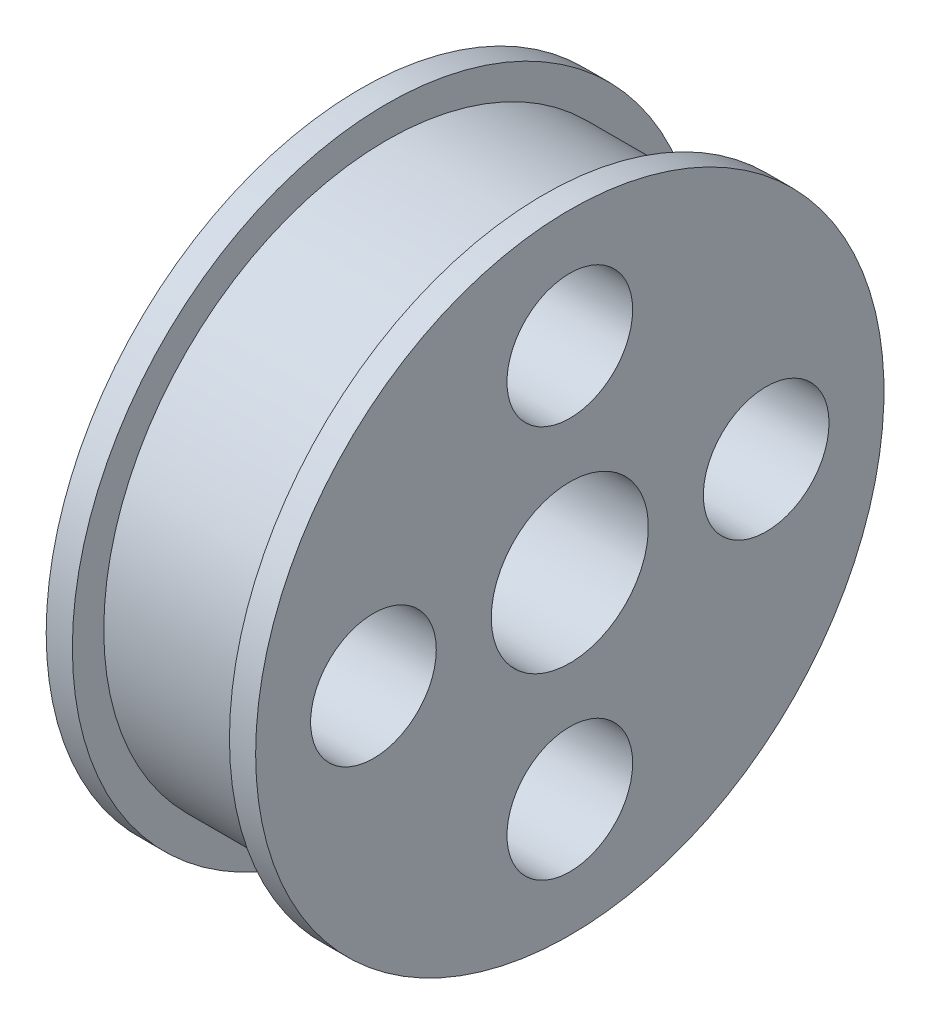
SolidWorks part; units mm, degrees
ref_plane "Front" through (0, 0, 0) normal (0, 0, 1) x (1, 0, 0)
ref_plane "Top" through (0, 0, 0) normal (0, 1, 0) x (1, 0, 0)
ref_plane "Right" through (0, 0, 0) normal (1, 0, 0) x (0, 0, -1)
sketch "Sketch1" plane through (0, 0, 0) normal (0, 0, 1) x (1, 0, 0)
  line L0 (0, 0) -> (40, 0) construction
  line L1 (0, 15) -> (40, 15)
  line L2 (5, 54) -> (35, 54)
  line L3 (0, 60) -> (5, 60)
  line L4 (0, 15) -> (0, 60)
  line L5 (40, 60) -> (40, 15)
  line L6 (35, 60) -> (35, 54)
  line L7 (5, 54) -> (5, 60)
  line L8 (35, 60) -> (40, 60)
  line L9 (0, 60) -> (40, 60) construction
  line L10 (5, 15) -> (5, 60) construction
  line L11 (0, 54) -> (40, 54) construction
  line L12 (35, 60) -> (35, 15) construction
  dimension "D1" = 40
revolve "Revolve1" add sketch "Sketch1" angle 360 about L0
sketch "Sketch2" plane through (40, 0, 0) normal (1, 0, 0) x (0, 0, -1)
  circle A0 centre (0, 0) radius 37.5 construction
  circle A1 centre (0, 37.5) radius 12
  circle A2 centre (37.5, 0) radius 12
  circle A3 centre (0, -37.5) radius 12
  circle A4 centre (-37.5, 0) radius 12
  dimension "D1" = 75
extrude "Cut-Extrude1" cut sketch "Sketch2" against normal through all
